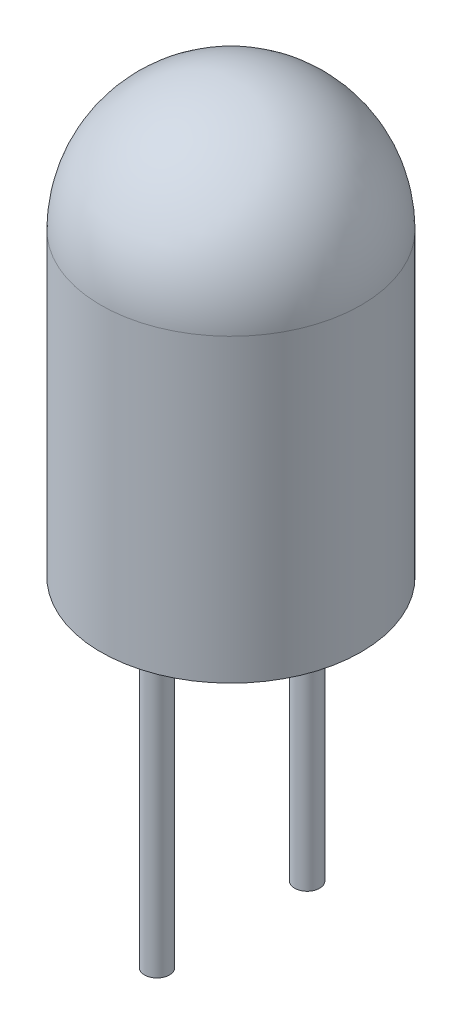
SolidWorks part; units mm, degrees
ref_plane "Face" through (0, 0, 0) normal (0, 0, 1) x (1, 0, 0)
ref_plane "Dessus" through (0, 0, 0) normal (0, 1, 0) x (1, 0, 0)
ref_plane "Droite" through (0, 0, 0) normal (1, 0, 0) x (0, 0, -1)
sketch "Esquisse1" plane through (0, 0, 0) normal (0, 0, 1) x (1, 0, 0)
  line L0 (0, -39.9143) -> (0, 34.7143) construction
  line L1 (0, -8.6) -> (2.6, -8.6)
  line L2 (2.6, -8.6) -> (2.6, -2.6)
  line L3 (0, -8.6) -> (0, 0)
  arc A0 (2.6, -2.6) -> (0, 0) centre (0, -2.6) ccw
  dimension "D1" = 2.6
  dimension "D2" = 6
revolve "Révolution1" add sketch "Esquisse1" angle 360 about L0
sketch "Esquisse2" plane through (0, -8.6, 0) normal (0, -1, 0) x (1, 0, 0)
  line L0 (10.5916, 0) -> (-9.3811, 0) construction
  circle A0 centre (0.0222, 1.4998) radius 0.25
  circle A1 centre (0.0222, -1.4998) radius 0.25
  circle A2 centre (0, 0) radius 2.6 construction
  dimension "D1" = 0.5
  dimension "D2" = 1.5
extrude "Extrusion1" add sketch "Esquisse2" along normal blind 6
sketch "Esquisse3" plane through (0, 0, 0) normal (0, 0, 1) x (1, 0, 0)
  point P0 (0, 0)
